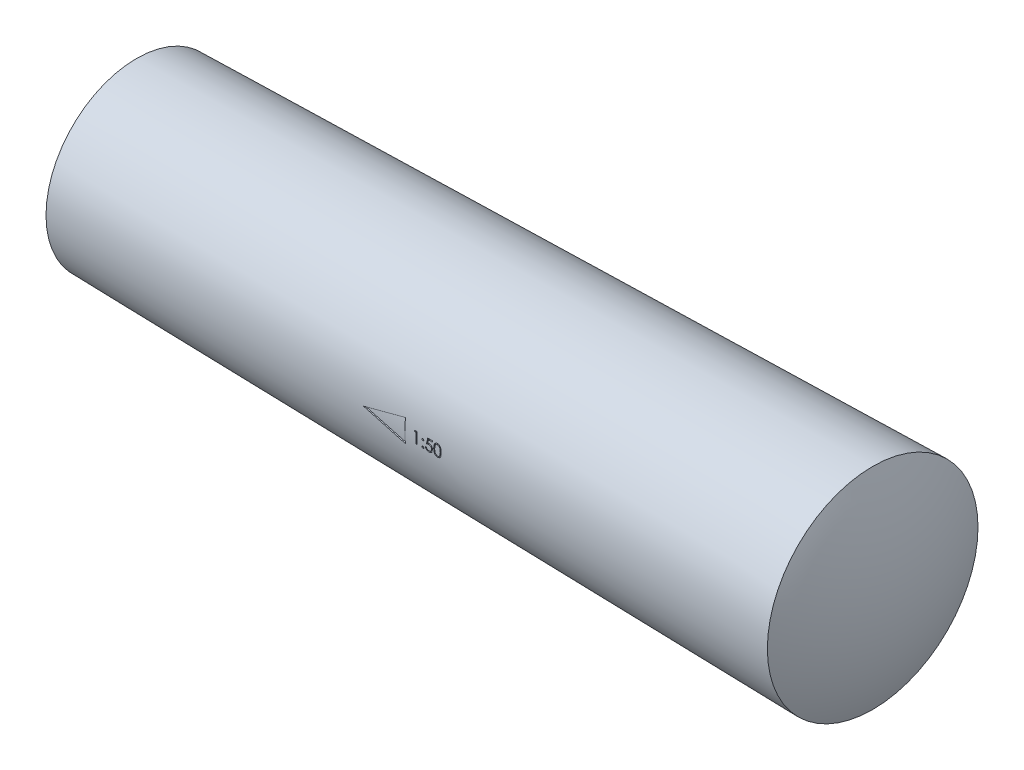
SolidWorks part; units mm, degrees
ref_plane "Front Plane" through (0, 0, 0) normal (0, 0, 1) x (1, 0, 0)
ref_plane "Top Plane" through (0, 0, 0) normal (0, 1, 0) x (1, 0, 0)
ref_plane "Right Plane" through (0, 0, 0) normal (1, 0, 0) x (0, 0, -1)
sketch "Sketch1" plane through (0, 0, 0) normal (1, 0, 0) x (0, 0, -1)
  circle A0 centre (0, 0) radius 8
  dimension "D1" = 16
extrude "Extrude1" add sketch "Sketch1" along normal mid plane 65
draft "Draft1" type of draft neutral plane draft angle 1.146 faces to draft 1 parameters "D1"=1.146
sketch "Sketch2" plane through (0, 0, 0) normal (0, 0, 1) x (1, 0, 0)
  line L0 (-32.5, 0) -> (-32.5, 8)
  line L1 (-32.5, 8) -> (-32.5, -8) construction
  line L2 (-32.5, 0) -> (-34.5, 0)
  line L3 (-34.5, 0) -> (-34.5, -8.65) construction
  line L4 (32.5, 0) -> (32.5, 9.3)
  line L5 (32.5, -9.3) -> (32.5, 9.3) construction
  line L6 (32.5, 0) -> (34.5, 0)
  line L7 (34.5, 0) -> (34.5, -8.65) construction
  line L8 (-32.5, -8) -> (32.5, -9.3) construction
  arc A0 (-34.5, 0) -> (-32.5, 8) centre (-17.5, 0) cw
  arc A1 (34.5, 0) -> (32.5, 9.3) centre (11.8773, 0) ccw
  point P14 (0, -8.65)
revolve "Revolve1" add sketch "Sketch2" angle 360 about L2
sketch "Sketch5" plane through (0, 0, 0) normal (0, 0, 1) x (1, 0, 0)
  line L0 (0, 8.65) -> (0, -8.65) construction
  line L1 (32.5, 9.3) -> (-32.5, 8) construction
  line L2 (-32.5, -8) -> (32.5, -9.3) construction
ref_plane "Plane2" through (0, 0, 0) normal (-0.02, 0, 0.9998) x (0.9998, 0, 0.02)
sketch "Sketch6" plane through (0, 0, 0) normal (-0.02, 0, 0.9998) x (0.9998, 0, 0.02)
  line L0 (0, 0) -> (0, 1)
  line L1 (0, 8.65) -> (0, -8.65) construction
  line L2 (0, 1) -> (-3.7321, 0)
  line L3 (-3.7321, 0) -> (0, -1)
  line L4 (0, -1) -> (0, 0)
  line L5 (0, -0.5) -> (4, -0.5) construction
  text T0 "1:50" font "Century Gothic" height 1
  dimension "D1" = 2
  dimension "D2" = 30
  dimension "D3" = 4
wrap "Wrap2" sketch "Sketch6" wrap type deboss source sketch "Sketch6" thickness 0.1 parameters "D1"=0.1
equation "\"D2@Sketch2\" = \"D1@Sketch2\""
